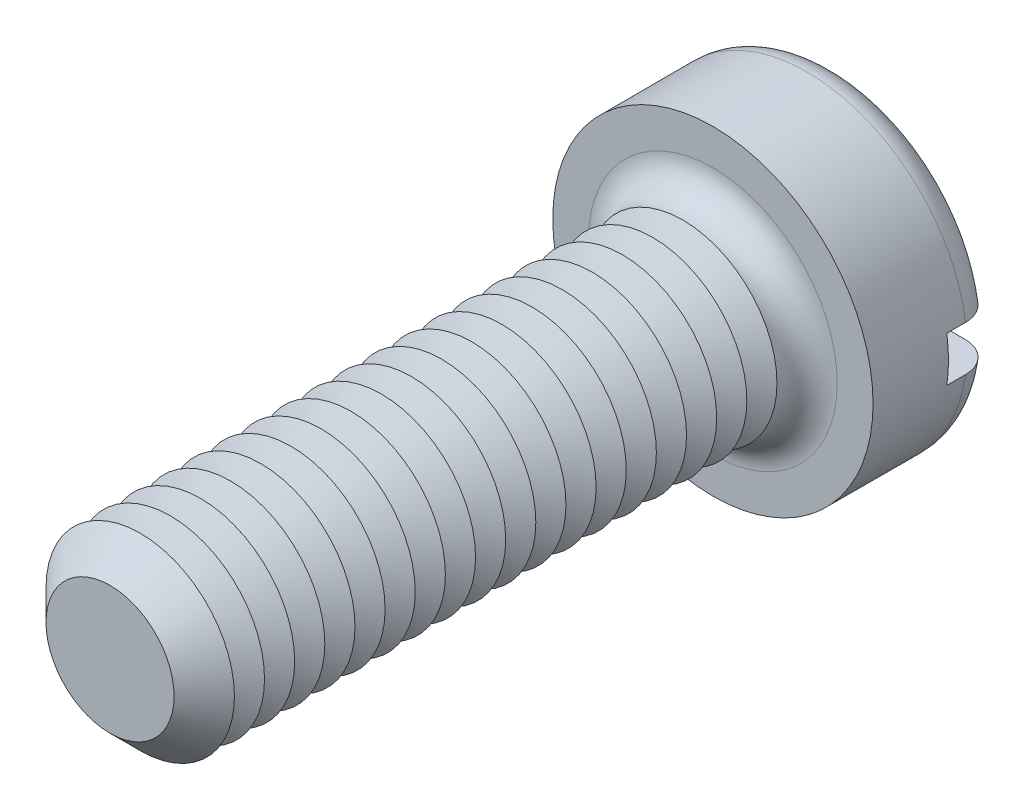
SolidWorks part; units mm, degrees
ref_plane "Front Plane" through (0, 0, 0) normal (0, 0, 1) x (1, 0, 0)
ref_plane "Top Plane" through (0, 0, 0) normal (0, 1, 0) x (1, 0, 0)
ref_plane "Right Plane" through (0, 0, 0) normal (1, 0, 0) x (0, 0, -1)
sketch "Sketch3" plane through (0, 0, 0) normal (0, 0, 1) x (1, 0, 0)
  circle A0 centre (0, 0) radius 4.25
  dimension "D1" = 8.5
extrude "Boss-Extrude2" add sketch "Sketch3" against normal blind 3.3
sketch "Sketch4" plane through (0, 0, 0) normal (0, 0, 1) x (1, 0, 0)
  circle A0 centre (0, 0) radius 2.5
  dimension "D1" = 5
extrude "Boss-Extrude3" add sketch "Sketch4" along normal blind 16
fillet "Fillet1" radius 0.8 2 edges at (4.25, 0, -3.3) (2.5, 0, 0)
chamfer "Chamfer1" distance 0.8 angle 45 1 edges at (2.5, 0, 16)
sketch "Sketch5" plane through (0, 0, 0) normal (1, 0, 0) x (0, 0, -1)
  line L0 (1.6944, 0) -> (-7.6738, 0) construction
sketch "Sketch6" plane through (0, 0, 0) normal (1, 0, 0) x (0, 0, -1)
  line L0 (-0.8, 2.5) -> (-1.2, 1.8072)
  line L1 (-1.2, 1.8072) -> (-1.6, 2.5)
  line L2 (-0.8, 2.5) -> (-15.2, 2.5) construction
  line L3 (-1.6, 2.5) -> (-0.8, 2.5)
  dimension "D1" = 0.8
revolve "Cut-Revolve1" cut sketch "Sketch6" angle 360 about L0
pattern_linear "LPattern1" count 18 spacing 0.8 along (0, 0, 1) of "Cut-Revolve1"
sketch "Sketch8" plane through (0, 0, -3.3) normal (0, 0, -1) x (-1, 0, 0)
  line L1 (4.25, -0.6) -> (-4.25, -0.6)
  line L2 (4.25, -0.6) -> (4.25, 0.6)
  line L3 (4.25, 0.6) -> (-4.25, 0.6)
  line L4 (-4.25, -0.6) -> (-4.25, 0.6)
  line L5 (4.25, -0.6) -> (-4.25, 0.6) construction
  line L6 (4.25, 0.6) -> (-4.25, -0.6) construction
  point P0 (0, 0)
  dimension "D1" = 8.5
  dimension "D2" = 1.2
extrude "Cut-Extrude1" cut sketch "Sketch8" against normal blind 1.3
